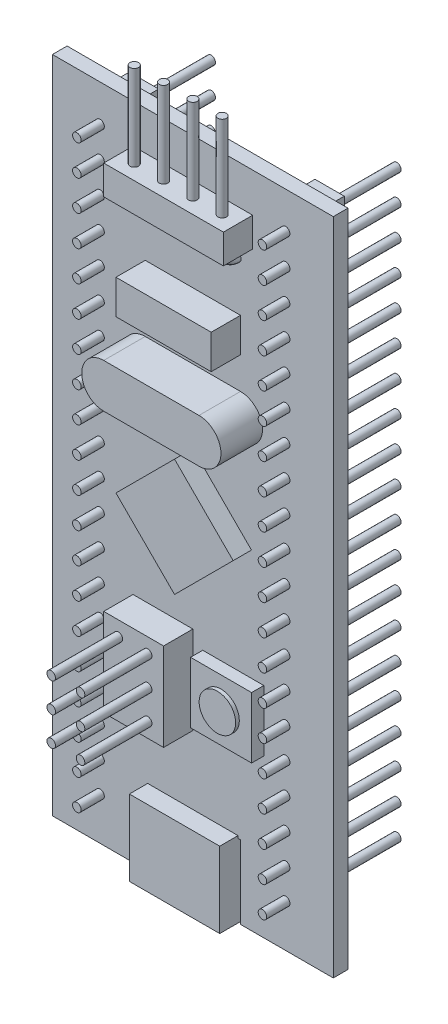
SolidWorks part; units mm, degrees
ref_plane "Спереди" through (0, 0, 0) normal (0, 0, 1) x (1, 0, 0)
ref_plane "Сверху" through (0, 0, 0) normal (0, 1, 0) x (1, 0, 0)
ref_plane "Справа" through (0, 0, 0) normal (1, 0, 0) x (0, 0, -1)
sketch "Эскиз1" plane through (0, 0, 0) normal (0, 0, 1) x (1, 0, 0)
  line L0 (0.4001, -30.8708) -> (0.4001, 23.1292) construction
  line L1 (-11.0999, 23.1292) -> (11.9001, 23.1292)
  line L2 (-11.0999, 23.1292) -> (-11.0999, -30.8708)
  line L3 (-11.0999, -30.8708) -> (11.9001, -30.8708)
  line L4 (11.9001, 23.1292) -> (11.9001, -30.8708)
  line L5 (-11.0999, -3.8708) -> (11.9001, -3.8708) construction
  dimension "D1" = 23
  dimension "D2" = 54
extrude "Бобышка-Вытянуть1" add sketch "Эскиз1" along normal blind 1.2
sketch "Эскиз2" plane through (0, 0, 0) normal (0, 0, -1) x (-1, 0, 0)
  line L0 (-0.4001, 23.1292) -> (-0.4001, -30.8708) construction
  line L1 (-11.9001, 23.1292) -> (11.0999, 23.1292) construction
  line L2 (11.0999, -30.8708) -> (-11.9001, -30.8708) construction
  line L3 (-9.2001, 21.4292) -> (-9.2001, -29.1708)
  line L4 (5.9999, 21.4292) -> (8.3999, 21.4292)
  line L5 (5.9999, 21.4292) -> (5.9999, -29.1708)
  line L6 (5.9999, -29.1708) -> (8.3999, -29.1708)
  line L7 (8.3999, 21.4292) -> (8.3999, -29.1708)
  line L8 (-6.8001, -29.1708) -> (-9.2001, -29.1708)
  line L9 (-6.8001, 21.4292) -> (-6.8001, -29.1708)
  line L10 (-6.8001, 21.4292) -> (-9.2001, 21.4292)
  line L11 (-0.4001, -3.8708) -> (-7.8164, -3.8708) construction
  point P16 (-6.8001, -3.8708)
  dimension "D1" = 2.4
  dimension "D2" = 50.6
  dimension "D3" = 17.6
extrude "Бобышка-Вытянуть2" add sketch "Эскиз2" along normal blind 2.4
sketch "Эскиз3" plane through (0, 0, -2.4) normal (0, 0, -1) x (-1, 0, 0)
  circle A0 centre (-8.0001, 20.1329) radius 0.35
  circle A1 centre (7.1999, 20.1329) radius 0.35
  circle A2 centre (7.1999, 17.6329) radius 0.35
  circle A3 centre (7.1999, 15.1329) radius 0.35
  circle A4 centre (7.1999, 12.6329) radius 0.35
  circle A5 centre (7.1999, 10.1329) radius 0.35
  circle A6 centre (7.1999, 7.6329) radius 0.35
  circle A7 centre (7.1999, 5.1329) radius 0.35
  circle A8 centre (7.1999, 2.6329) radius 0.35
  circle A9 centre (7.1999, 0.1329) radius 0.35
  circle A10 centre (7.1999, -2.3671) radius 0.35
  circle A11 centre (7.1999, -4.8671) radius 0.35
  circle A12 centre (7.1999, -7.3671) radius 0.35
  circle A13 centre (7.1999, -9.8671) radius 0.35
  circle A14 centre (7.1999, -12.3671) radius 0.35
  circle A15 centre (7.1999, -14.8671) radius 0.35
  circle A16 centre (7.1999, -17.3671) radius 0.35
  circle A17 centre (7.1999, -19.8671) radius 0.35
  circle A18 centre (7.1999, -22.3671) radius 0.35
  circle A19 centre (7.1999, -24.8671) radius 0.35
  circle A20 centre (7.1999, -27.3671) radius 0.35
  circle A21 centre (-8.0001, 17.6329) radius 0.35
  circle A22 centre (-8.0001, 15.1329) radius 0.35
  circle A23 centre (-8.0001, 12.6329) radius 0.35
  circle A24 centre (-8.0001, 10.1329) radius 0.35
  circle A25 centre (-8.0001, 7.6329) radius 0.35
  circle A26 centre (-8.0001, 5.1329) radius 0.35
  circle A27 centre (-8.0001, 2.6329) radius 0.35
  circle A28 centre (-8.0001, 0.1329) radius 0.35
  circle A29 centre (-8.0001, -2.3671) radius 0.35
  circle A30 centre (-8.0001, -4.8671) radius 0.35
  circle A31 centre (-8.0001, -7.3671) radius 0.35
  circle A32 centre (-8.0001, -9.8671) radius 0.35
  circle A33 centre (-8.0001, -12.3671) radius 0.35
  circle A34 centre (-8.0001, -14.8671) radius 0.35
  circle A35 centre (-8.0001, -17.3671) radius 0.35
  circle A36 centre (-8.0001, -19.8671) radius 0.35
  circle A37 centre (-8.0001, -22.3671) radius 0.35
  circle A38 centre (-8.0001, -24.8671) radius 0.35
  circle A39 centre (-8.0001, -27.3671) radius 0.35
  dimension "D1" = 0.7
  dimension "D2" = 2
  dimension "D3" = 20
extrude "Бобышка-Вытянуть3" add sketch "Эскиз3" along normal mid plane 11
sketch "Эскиз4" plane through (0, 0, 1.2) normal (0, 0, 1) x (1, 0, 0)
  line L0 (0.4001, 23.1292) -> (0.4001, -30.8708) construction
  line L1 (-4.4999, 19.9292) -> (5.3001, 19.9292)
  line L2 (-4.4999, 19.9292) -> (-4.4999, 17.5292)
  line L3 (-4.4999, 17.5292) -> (5.3001, 17.5292)
  line L4 (5.3001, 19.9292) -> (5.3001, 17.5292)
  line L5 (-4.4999, -11.8708) -> (0.4001, -11.8708)
  line L6 (-4.4999, -11.8708) -> (-4.4999, -19.0708)
  line L7 (-4.4999, -19.0708) -> (0.4001, -19.0708)
  line L8 (0.4001, -11.8708) -> (0.4001, -19.0708)
  line L9 (-3.4999, 12.3292) -> (4.3001, 12.3292)
  line L10 (-3.4999, 12.3292) -> (-3.4999, 9.5292)
  line L11 (-3.4999, 9.5292) -> (4.3001, 9.5292)
  line L12 (4.3001, 12.3292) -> (4.3001, 9.5292)
  line L13 (11.9001, 23.1292) -> (-11.0999, 23.1292) construction
  line L14 (-11.0999, -30.8708) -> (11.9001, -30.8708) construction
  point P18 (5.3001, 18.7292)
  dimension "D1" = 2.4
  dimension "D2" = 4.9
  dimension "D3" = 4.9
  dimension "D4" = 4.9
  dimension "D5" = 7.8
  dimension "D6" = 3.9
  dimension "D7" = 5.6
  dimension "D8" = 10.4
  dimension "D9" = 2.8
  dimension "D10" = 19
  dimension "D11" = 7.2
extrude "Бобышка-Вытянуть4" add sketch "Эскиз4" along normal blind 2.4
sketch "Эскиз5" plane through (0, 19.9292, 0) normal (0, 1, 0) x (1, 0, 0)
  line L0 (5.3001, -3.6) -> (-4.4999, -3.6) construction
  circle A0 centre (-3.1999, -2.4) radius 0.35
  circle A1 centre (-0.7999, -2.4) radius 0.35
  circle A2 centre (1.6001, -2.4) radius 0.35
  circle A3 centre (4.0001, -2.4) radius 0.35
  point P4 (0.4001, -3.6)
  dimension "D1" = 0.7
  dimension "D2" = 3.6
  dimension "D3" = 4
extrude "Бобышка-Вытянуть5" add sketch "Эскиз5" along normal blind 7
sketch "Эскиз6" plane through (0, 17.5292, 0) normal (0, -1, 0) x (1, 0, 0)
  line L0 (0.4001, 3.6) -> (0.4001, 1.2) construction
  line L1 (-4.4999, 1.2) -> (5.3001, 1.2) construction
  circle A0 centre (-3.1999, 2.4) radius 0.35
  circle A1 centre (-0.7999, 2.4) radius 0.35
  circle A2 centre (1.6001, 2.4) radius 0.35
  circle A3 centre (4.0001, 2.4) radius 0.35
  dimension "D1" = 0.7
  dimension "D2" = 3.6
  dimension "D3" = 4
revolve "Повернуть1" add sketch "Эскиз6" angle 360 about L1
sketch "Эскиз7" plane through (0, 0, 3.6) normal (0, 0, 1) x (1, 0, 0)
  line L0 (-4.4999, -11.8708) -> (-4.4999, -19.0708) construction
  line L1 (0.4001, -11.8708) -> (-4.4999, -11.8708) construction
  circle A0 centre (-3.2999, -13.0708) radius 0.35
  circle A1 centre (-0.8999, -13.0708) radius 0.35
  circle A2 centre (-0.8999, -15.4708) radius 0.35
  circle A3 centre (-0.8999, -17.8708) radius 0.35
  circle A4 centre (-3.2999, -15.4708) radius 0.35
  circle A5 centre (-3.2999, -17.8708) radius 0.35
  dimension "D1" = 0.7
  dimension "D2" = 1.2
  dimension "D3" = 1.2
  dimension "D4" = 2
  dimension "D5" = 3
extrude "Бобышка-Вытянуть6" add sketch "Эскиз7" along normal mid plane 11
sketch "Эскиз8" plane through (0, 0, 1.2) normal (0, 0, 1) x (1, 0, 0)
  line L0 (0.4001, 23.1292) -> (0.4001, -30.8708) construction
  line L1 (11.9001, 23.1292) -> (-11.0999, 23.1292) construction
  line L2 (-11.0999, -30.8708) -> (11.9001, -30.8708) construction
  line L3 (-11.0999, -3.8708) -> (11.9001, -3.8708) construction
  line L4 (-11.0999, 23.1292) -> (-11.0999, -30.8708) construction
  line L5 (11.9001, -30.8708) -> (11.9001, 23.1292) construction
  line L6 (-4.3999, -3.8708) -> (0.4001, 0.9292)
  line L7 (0.4001, 0.9292) -> (5.2001, -3.8708)
  line L8 (5.2001, -3.8708) -> (0.4001, -8.6708)
  line L9 (0.4001, -8.6708) -> (-4.3999, -3.8708)
  line L11 (-3.2999, -30.8708) -> (4.1001, -30.8708)
  line L12 (-3.2999, -30.8708) -> (-3.2999, -24.6708)
  line L13 (-3.2999, -24.6708) -> (4.1001, -24.6708)
  line L14 (4.1001, -30.8708) -> (4.1001, -24.6708)
  point P20 (0.4001, -24.6708)
  dimension "D1" = 45
  dimension "D2" = 4.8
  dimension "D3" = 7.4
  dimension "D4" = 6.2
extrude "Бобышка-Вытянуть7" add sketch "Эскиз8" along normal blind 1.5
sketch "Эскиз9" plane through (0, 0, 1.2) normal (0, 0, 1) x (1, 0, 0)
  line L0 (-3.4999, 5.1292) -> (4.3001, 5.1292) construction
  line L1 (-3.4999, 6.9292) -> (4.3001, 6.9292)
  line L2 (-3.4999, 3.3292) -> (4.3001, 3.3292)
  line L3 (4.3001, 12.3292) -> (-3.4999, 12.3292) construction
  arc A0 (-3.4999, 6.9292) -> (-3.4999, 3.3292) centre (-3.4999, 5.1292) ccw
  arc A1 (4.3001, 3.3292) -> (4.3001, 6.9292) centre (4.3001, 5.1292) ccw
  point P2 (0.4001, 5.1292)
  dimension "D1" = 3.6
  dimension "D2" = 9
extrude "Бобышка-Вытянуть8" add sketch "Эскиз9" along normal blind 3.4
sketch "Эскиз10" plane through (0, 0, 1.2) normal (0, 0, 1) x (1, 0, 0)
  line L1 (1.2093, -12.9708) -> (6.2093, -12.9708)
  line L2 (1.2093, -12.9708) -> (1.2093, -17.9708)
  line L3 (1.2093, -17.9708) -> (6.2093, -17.9708)
  line L4 (6.2093, -12.9708) -> (6.2093, -17.9708)
  circle A0 centre (3.7093, -15.4708) radius 2.5 construction
  dimension "D1" = 5
extrude "Бобышка-Вытянуть9" add sketch "Эскиз10" along normal blind 1
sketch "Эскиз11" plane through (0, 0, 2.2) normal (0, 0, 1) x (1, 0, 0)
  circle A0 centre (3.7093, -15.4708) radius 1.4951
extrude "Бобышка-Вытянуть10" add sketch "Эскиз11" along normal blind 0.3
sketch "Эскиз12" plane through (0, -30.8708, 0) normal (0, -1, 0) x (1, 0, 0)
  line L0 (-3.484, 1.2) -> (-3.484, 0)
  line L1 (-4.4999, 1.2) -> (0.4001, 1.2) construction
  line L2 (-11.0999, 0) -> (11.9001, 0) construction
  line L4 (-2.7206, 0.1855) -> (-3.2999, 0.727)
  line L5 (-3.2999, 0.727) -> (-3.2999, 1.2)
  line L6 (-3.2999, 1.2) -> (-3.484, 1.2)
  line L7 (0.4001, 0) -> (0.4001, 2.7) construction
  line L8 (-3.2999, 2.7) -> (4.1001, 2.7) construction
  line L9 (4.1001, 0.727) -> (4.1001, 1.2)
  line L10 (3.5208, 0.1855) -> (4.1001, 0.727)
  line L12 (4.2842, 1.2) -> (4.2842, 0)
  line L13 (4.1001, 1.2) -> (4.2842, 1.2)
  line L14 (-2.7206, 0.1855) -> (3.5208, 0.1855)
  line L15 (4.2842, 0) -> (-3.484, 0)
extrude "Вырез-Вытянуть1" cut sketch "Эскиз12" against normal blind 6
